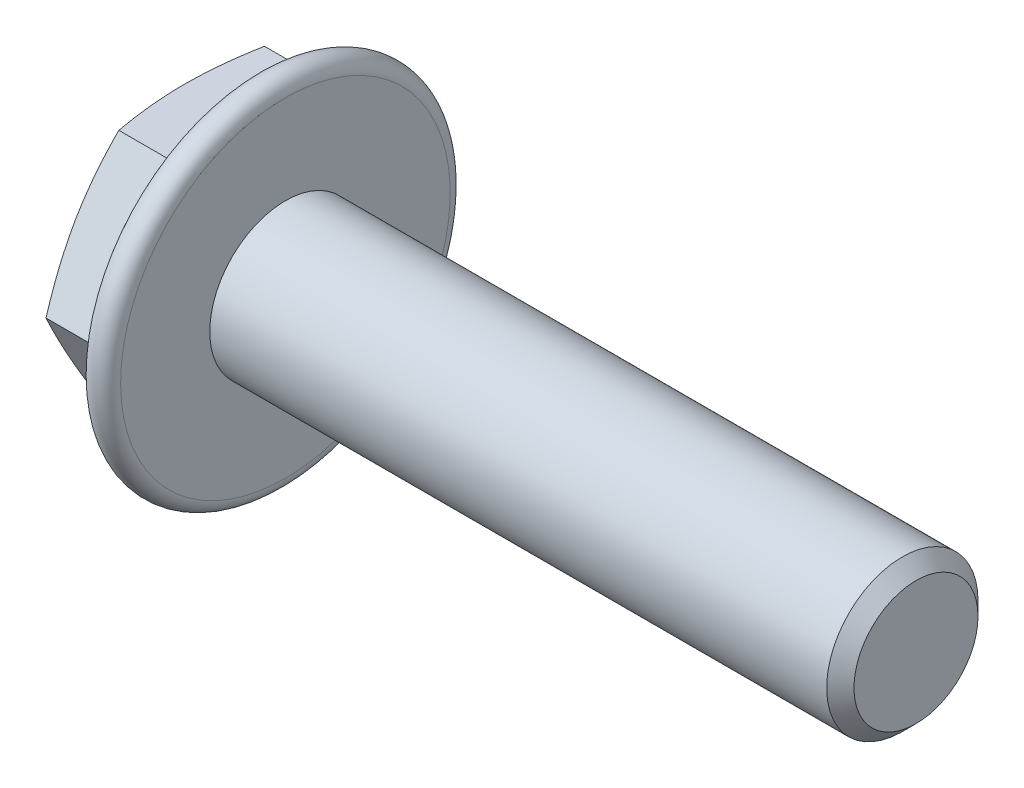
SolidWorks part; units mm, degrees
ref_plane "Front" through (0, 0, 0) normal (0, 0, 1) x (1, 0, 0)
ref_plane "Top" through (0, 0, 0) normal (0, 1, 0) x (1, 0, 0)
ref_plane "Right" through (0, 0, 0) normal (1, 0, 0) x (0, 0, -1)
sketch "Sketch1" plane through (0, 0, 0) normal (1, 0, 0) x (0, 0, -1)
  line L1 (5.7735, 0) -> (2.8868, 5)
  line L2 (2.8868, 5) -> (-2.8868, 5)
  line L3 (-2.8868, 5) -> (-5.7735, 0)
  line L4 (-5.7735, 0) -> (-2.8868, -5)
  line L5 (-2.8868, -5) -> (2.8868, -5)
  line L6 (2.8868, -5) -> (5.7735, 0)
  circle A0 centre (0, 0) radius 5 construction
  dimension "s" = 10
extrude "BaseHead" add sketch "Sketch1" along normal blind 4
ref_plane "Plane1" through (12, 0, 0) normal (1, 0, 0) x (0, 0, -1)
sketch "Sketch2" plane through (4, 0, 0) normal (1, 0, 0) x (0, 0, -1)
  circle A0 centre (0, 0) radius 3
  dimension "d" = 6
extrude "BaseBody" add sketch "Sketch2" along normal blind 25
sketch "Sketch3" plane through (-0.4952, 0, 6.2687) normal (0, 1, 0) x (0, 0, -1)
  line L0 (12.0422, -0.4952) -> (12.0422, -0.7767)
  line L2 (12.0422, -0.7767) -> (11.2687, -0.4952)
  line L4 (11.2687, -0.4952) -> (12.0422, -0.4952)
  line L5 (6.2687, 4.1693) -> (6.2687, -11.9236) construction
  dimension "D1" = 20
  dimension "da" = 10
revolve "HeadChamfer" cut sketch "Sketch3" angle 360 about L5
sketch "Sketch5" plane through (-0.1752, 0, 7.2752) normal (0, 1, 0) x (0, 0, -1)
  line L0 (7.2752, -4.1752) -> (7.2752, -7.1738) construction
  line L2 (7.2752, -4.1752) -> (13.8081, -4.1752)
  line L3 (14.002, -3.0752) -> (7.2752, -0.6268)
  line L4 (7.2752, -0.6268) -> (7.2752, -4.1752)
  line L7 (7.2752, 4.4893) -> (7.2752, -11.6035) construction
  arc A0 (13.8081, -4.1752) -> (14.002, -3.0752) centre (13.8081, -3.6081) ccw
  dimension "D3" = 20
  dimension "c" = 1.1
  dimension "dc" = 14.2
revolve "Flange" add sketch "Sketch5" angle 360 about L0
fillet "HeadFillet" [suppressed] radius 0.3
fillet "FlangeHexFillet" radius 0.4 6 edges
chamfer "Chamfer1" distance 0.5415 angle 45 1 edges at (29, 0, -3)
sketch "Sketch6" plane through (0, 0, 0) normal (0, 0, 1) x (1, 0, 0)
  line L0 (27.917, 3.5415) -> (28.4585, 3.5415)
  line L1 (28.4585, 3.5415) -> (28.4585, 3)
  line L2 (28.4585, 3) -> (28.1877, 2.531)
  line L3 (28.1877, 2.531) -> (27.917, 3)
  line L4 (27.917, 3) -> (27.917, 3.5415)
  line L5 (28.4585, 3) -> (4, 3) construction
  dimension "D1" = 0.5415
revolve "Cut-Revolve10" [suppressed] cut sketch "Sketch6" angle 360
pattern_linear "LPattern10" [suppressed] count 26
equation "\"D1@Chamfer1\" = (  \"d@Sketch2\" - \"D2@ThreadCosmetic1\" )  / 2"
equation "\"b@ThreadCosmetic1\" = \"l@BaseBody\" - \"lg@Plane1\""
equation "\"da@Sketch3\" = \"s@Sketch1\""
equation "\"D1@Sketch6\" =  ( \"d@Sketch2\" - \"D2@ThreadCosmetic1\" )  / 2"
equation "\"pitch@LPattern10\" = 1.2 * \"D1@Sketch6\""
equation "\"D1@LPattern10\" = \"b@ThreadCosmetic1\" / \"pitch@LPattern10\""
